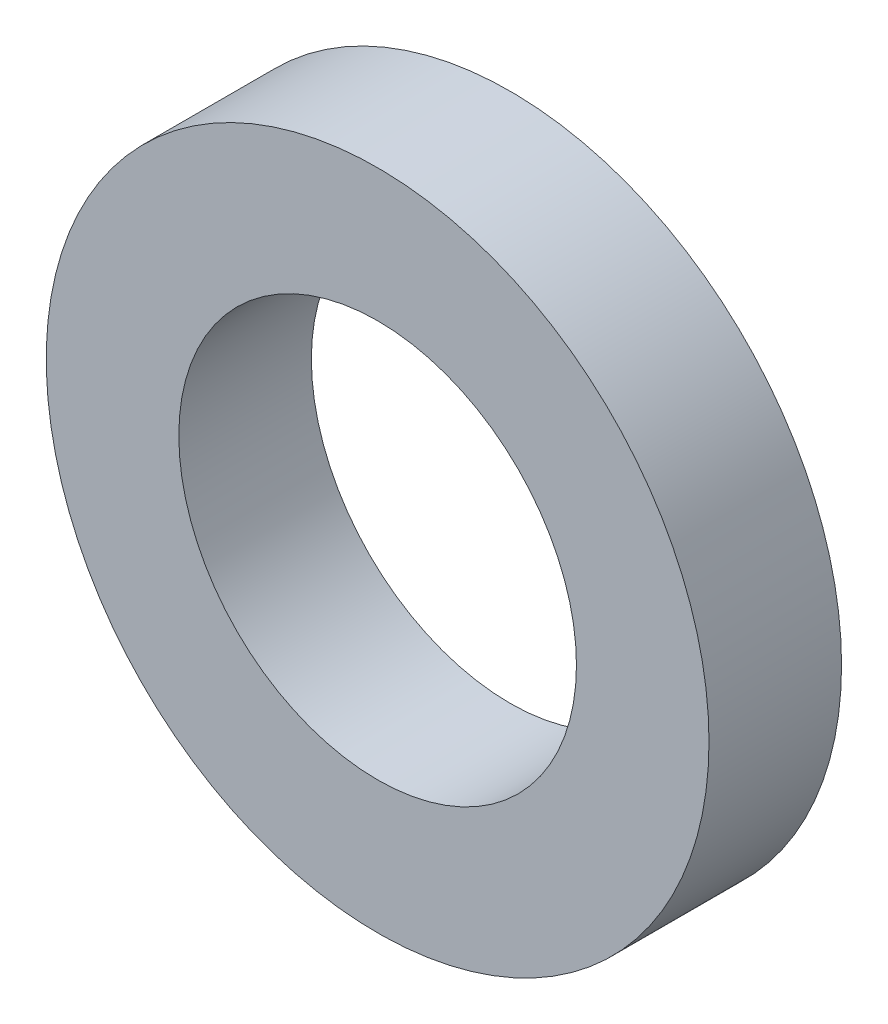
SolidWorks part; units mm, degrees
ref_plane "Front" through (0, 0, 0) normal (0, 0, 1) x (1, 0, 0)
ref_plane "Top" through (0, 0, 0) normal (0, 1, 0) x (1, 0, 0)
ref_plane "Right" through (0, 0, 0) normal (1, 0, 0) x (0, 0, -1)
sketch "Sketch1" plane through (0, 0, 0) normal (0, 1, 0) x (1, 0, 0)
  line L0 (0, -0.635) -> (0, 0.635) construction
  line L1 (0, -0.55) -> (0, 0.55) construction
  line L3 (-1.5, 0) -> (1.5, 0) construction
  line L4 (1.5, -0.365) -> (1.5, 0.635)
  line L5 (1.5, -0.365) -> (2.5, -0.365)
  line L6 (1.5, 0.635) -> (2.5, 0.635)
  line L7 (2.5, -0.365) -> (2.5, 0.635)
  point P9 (1.5, 0)
  point P10 (1.8034, 0)
  point P13 (1.1684, 0.635)
  point P14 (1.1684, -0.635)
revolve "Revolve1" add sketch "Sketch1" angle 360 about L0
sketch "Sketch3" plane through (0, 0, 0) normal (1, 0, 0) x (0, 0, -1)
  line L0 (-0.5, 0) -> (0.5, 0) construction
  point P6 (0, 0)
  point P7 (0, 0)
sketch "Sketch4" plane through (0, 0, 0) normal (0, 0, 1) x (1, 0, 0)
  line L1 (0, 0) -> (-2.4435, 0.5284) construction
  circle A0 centre (0, 0) radius 2.5 construction
equation "\"D1@Sketch3\" = \"Width@Sketch1\""
equation "\"D1@Sketch1\" = \"Width@Sketch1\""
